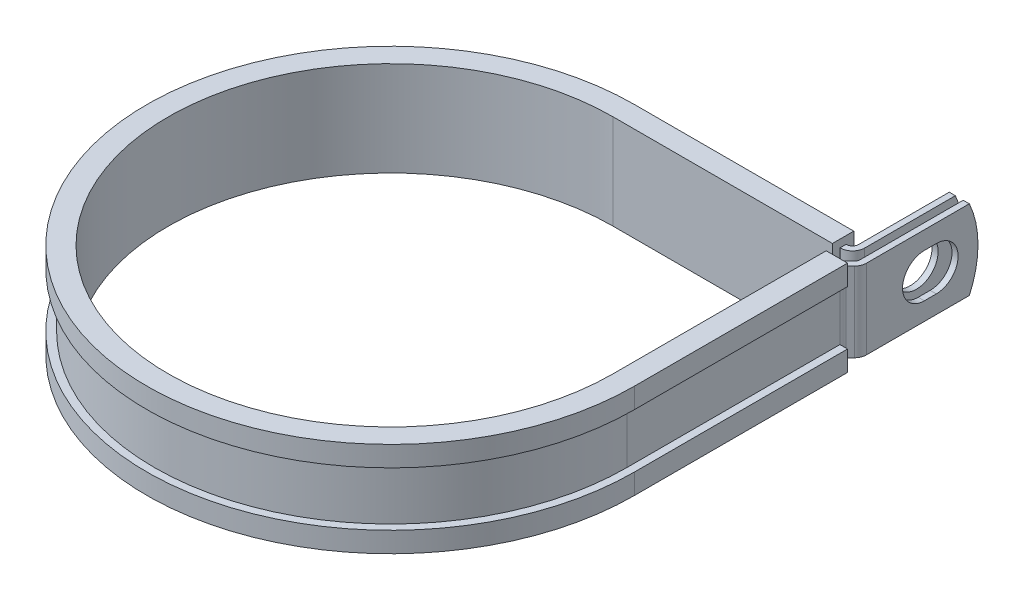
SolidWorks part; units mm, degrees
ref_plane "Front Plane" through (0, 0, 0) normal (0, 0, 1) x (1, 0, 0)
ref_plane "Top Plane" through (0, 0, 0) normal (0, 1, 0) x (1, 0, 0)
ref_plane "Right Plane" through (0, 0, 0) normal (1, 0, 0) x (0, 0, -1)
sketch "Sketch1" plane through (0, 0, 0) normal (0, 1, 0) x (1, 0, 0)
  line L0 (0, 45.974) -> (43.8583, 45.974)
  line L1 (45.974, 0) -> (45.974, 42.5615)
  line L2 (46.2967, 68.2498) -> (46.2967, 48.4124)
  line L3 (46.6882, 44.2857) -> (47.5144, 45.1119)
  line L5 (47.8715, 45.974) -> (47.8715, 68.2498)
  arc A0 (0, 45.974) -> (45.974, 0) centre (0, 0) ccw
  arc A1 (46.6882, 44.2857) -> (45.974, 42.5615) centre (48.4124, 42.5615) ccw
  arc A2 (47.5144, 45.1119) -> (47.8715, 45.974) centre (46.6523, 45.974) ccw
  arc A3 (43.8583, 45.974) -> (46.2967, 48.4124) centre (43.8583, 48.4124) ccw
extrude "Extrude-Thin1" add sketch "Sketch1" along normal mid plane 15.875 thin
sketch "Sketch2" plane through (45.0775, 0, 0) normal (-1, 0, 0) x (0, 0, 1)
  line L0 (-68.2498, 7.9375) -> (-68.2498, -7.9375) construction
  line L1 (0, 7.9375) -> (0, -7.9375) construction
  circle A0 centre (-58.7248, 0) radius 4.3561
  point P2 (-68.2498, 0)
extrude "Cut-Extrude1" cut sketch "Sketch2" against normal up to surface (1.2192 mm away)
sketch "Sketch3" plane through (49.0907, 0, 0) normal (1, 0, 0) x (0, 0, -1)
  line L0 (57.531, 0) -> (59.9186, 0) construction
  line L1 (57.531, 4.3561) -> (59.9186, 4.3561)
  line L2 (57.531, -4.3561) -> (59.9186, -4.3561)
  line L3 (68.2498, 7.9375) -> (68.2498, -7.9375) construction
  arc A0 (57.531, 4.3561) -> (57.531, -4.3561) centre (57.531, 0) ccw
  arc A1 (59.9186, -4.3561) -> (59.9186, 4.3561) centre (59.9186, 0) ccw
  point P3 (58.7248, 0)
  point P8 (68.2498, 0)
  point P11 (53.1749, 0)
  point P12 (64.2747, 0)
extrude "Cut-Extrude2" cut sketch "Sketch3" against normal up to surface (1.2192 mm away)
sketch "Sketch4" plane through (45.0775, 0, 0) normal (-1, 0, 0) x (0, 0, 1)
  line L0 (-68.2498, 7.9375) -> (-68.2498, -7.9375)
  line L1 (-68.2498, 7.9375) -> (-66.5174, 7.9375)
  line L2 (-68.2498, 7.9375) -> (-48.4124, 7.9375) construction
  line L3 (-68.2498, -7.9375) -> (-66.5174, -7.9375)
  line L4 (-68.2498, -7.9375) -> (-48.4124, -7.9375) construction
  arc A0 (-66.5174, 7.9375) -> (-66.5174, -7.9375) centre (-49.1998, 0) ccw
extrude "Cut-Extrude3" cut sketch "Sketch4" against normal through all contours A0 M4 M5 | A0 L0 M2
ref_plane "Plane1" through (0, 0, -42.5615) normal (0, 0, -1) x (-1, 0, 0)
ref_plane "Plane2" through (43.8075, 0, 0) normal (-1, 0, 0) x (0, 0, 1)
sketch "Sketch5" plane through (0, 0, -42.5615) normal (0, 0, -1) x (-1, 0, 0)
  line L0 (-47.1932, 7.9375) -> (-45.974, 7.9375)
  line L1 (-47.1932, 7.9375) -> (-47.1932, -7.9375) construction
  line L3 (-45.974, 7.9375) -> (-45.974, -7.9375)
  line L4 (-45.974, -7.9375) -> (-47.1932, -7.9375)
  line L5 (-47.1932, -7.9375) -> (-47.1932, -5.3975)
  line L6 (-47.1932, 7.9375) -> (-47.1932, 5.3975)
  line L7 (-48.7172, 9.4615) -> (-48.7172, 5.3975)
  line L8 (-48.7172, 9.4615) -> (-44.45, 9.4615)
  line L9 (-44.45, 9.4615) -> (-44.45, -9.4615)
  line L10 (-44.45, -9.4615) -> (-48.7172, -9.4615)
  line L11 (-48.7172, -9.4615) -> (-48.7172, -5.3975)
  line L12 (-48.7172, 5.3975) -> (-47.1932, 5.3975)
  line L13 (-47.1932, -5.3975) -> (-48.7172, -5.3975)
sketch "Sketch6" plane through (0, 7.9375, 0) normal (0, 1, 0) x (1, 0, 0)
  line L0 (44.45, 0) -> (44.45, 42.5615)
  line L1 (44.45, 42.5615) -> (48.7172, 42.5615) construction
  line L2 (43.8075, 6.9878) -> (43.8075, -6.9878) construction
  line L5 (0, 44.45) -> (43.8075, 44.45)
  arc A0 (0, 44.45) -> (44.45, 0) centre (0, 0) ccw
sweep "Sweep1" add profiles "Sketch5" path "Sketch6"
equation "\"D4@Sketch5\" = \"D1@Extrude-Thin1\""
equation "\"D5@Sketch5\" = \"D5@Extrude-Thin1\""
equation "\"D1@Sketch3\" = \"D2@Sketch2\""
equation "\"D7@Sketch1\" = \"D3@Sketch2\" + \"D1@Sketch3\""
equation "\"D1@Sketch1\" = \"D1@Sketch6\" + 2 * \"D3@Sketch5\""
equation "\"D1@Sketch4\" = ( \"D1@Extrude-Thin1\" + .125 ) * 2"
equation "\"D9@Sketch1\"= \"D5@Extrude-Thin1\""
equation "\"D8@Sketch1\"= 2 * \"D5@Extrude-Thin1\""
equation "\"D2@Sketch1\" = 2 * \"D5@Extrude-Thin1\""
equation "\"D2@Sketch3\" = \"D1@Sketch2\""
